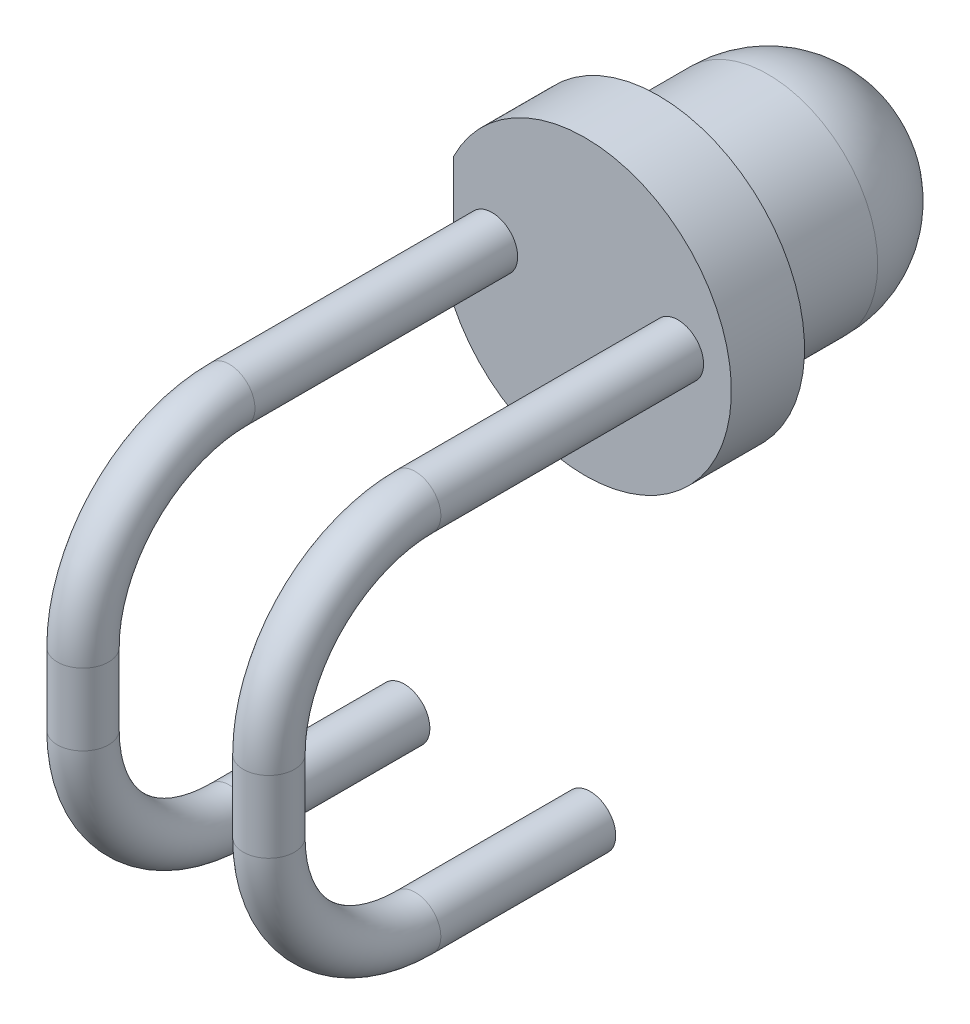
SolidWorks part; units mm, degrees
ref_plane "Face" through (0, 0, 0) normal (0, 0, 1) x (1, 0, 0)
ref_plane "Dessus" through (0, 0, 0) normal (0, 1, 0) x (1, 0, 0)
ref_plane "Droite" through (0, 0, 0) normal (1, 0, 0) x (0, 0, -1)
sketch "Esquisse1" plane through (0, 0, 0) normal (0, 0, 1) x (1, 0, 0)
  circle A0 centre (0, 0) radius 1.5
  dimension "D1" = 3
extrude "Base-Extrusion" add sketch "Esquisse1" along normal blind 4
sketch "Esquisse2" plane through (0, 0, 4) normal (0, 0, 1) x (1, 0, 0)
  line L0 (-1.8, -2.4917) -> (-1.8, 2.5621) construction
  line L1 (-1.8, 0.8718) -> (-1.8, -0.8718)
  arc A0 (-1.8, -0.8718) -> (-1.8, 0.8718) centre (0, 0) ccw
extrude "Boss.-Extru.1" add sketch "Esquisse2" against normal blind 1
fillet "Congé1" radius 1.5 1 edges at (1.5, 0, 0)
ref_plane "Plan1" through (1.27, 0, 0) normal (1, 0, 0) x (0, 0, -1)
sketch "Esquisse9" plane through (1.27, 0, 0) normal (1, 0, 0) x (0, 0, -1)
  line L0 (-4, 0.1287) -> (-7.59, 0.1287)
  line L1 (-9.59, -1.8713) -> (-9.59, -2.8513)
  line L2 (-7.59, -4.8513) -> (-5.2, -4.8513)
  arc A0 (-7.59, 0.1287) -> (-9.59, -1.8713) centre (-7.59, -1.8713) ccw
  arc A1 (-9.59, -2.8513) -> (-7.59, -4.8513) centre (-7.59, -2.8513) ccw
  point P12 (-9.59, 0.1287)
  point P15 (-9.59, -4.8513)
  dimension "D1" = 2
sketch "Esquisse10" plane through (0, 0, 4) normal (0, 0, 1) x (1, 0, 0)
  circle A0 centre (1.27, 0.1287) radius 0.35
sweep "Balayage1" add profiles "Esquisse10" path "Esquisse9"
sketch "Esquisse11" plane through (0, 0, 4) normal (0, 0, 1) x (1, 0, 0)
  line L0 (-2.8136, 0) -> (3.6896, 0)
pattern_linear "Répétition linéaire1" count 2 spacing 2.54 along (-1, 0, 0) of "Balayage1"
